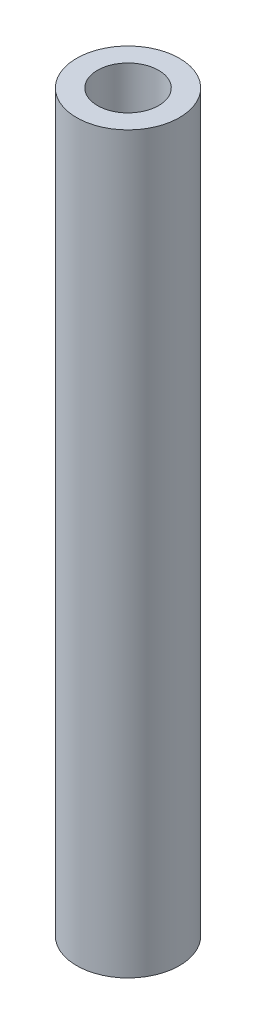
SolidWorks part; units mm, degrees
ref_plane "Front Plane" through (0, 0, 0) normal (0, 0, 1) x (1, 0, 0)
ref_plane "Top Plane" through (0, 0, 0) normal (0, 1, 0) x (1, 0, 0)
ref_plane "Right Plane" through (0, 0, 0) normal (1, 0, 0) x (0, 0, -1)
sketch "Sketch1" plane through (0, 0, 0) normal (0, 1, 0) x (1, 0, 0)
  circle A0 centre (0, 0) radius 6.35
  circle A1 centre (0, 0) radius 10.668
  dimension "D1" = 21.336
  dimension "D2" = 12.7
extrude "Boss-Extrude1" add sketch "Sketch1" along normal blind 152.4
sketch "Sketch2" [suppressed] plane through (0, 0, 0) normal (0, 0, 1) x (1, 0, 0)
  line L0 (10.668, 0) -> (10.668, 152.4) construction
  line L1 (10.668, 0) -> (10.668, 152.4)
  line L2 (10.668, 139.7) -> (11.938, 139.7)
  line L3 (11.938, 139.7) -> (11.938, 114.3)
  line L4 (11.938, 114.3) -> (10.668, 114.3)
  line L5 (0, 152.4) -> (0, 0) construction
  line L6 (10.668, 152.4) -> (-10.668, 152.4) construction
  dimension "D1" = 1.27
  dimension "D2" = 25.4
  dimension "D3" = 12.7
revolve "Revolve1" [suppressed] add sketch "Sketch2" angle 360 about L5
